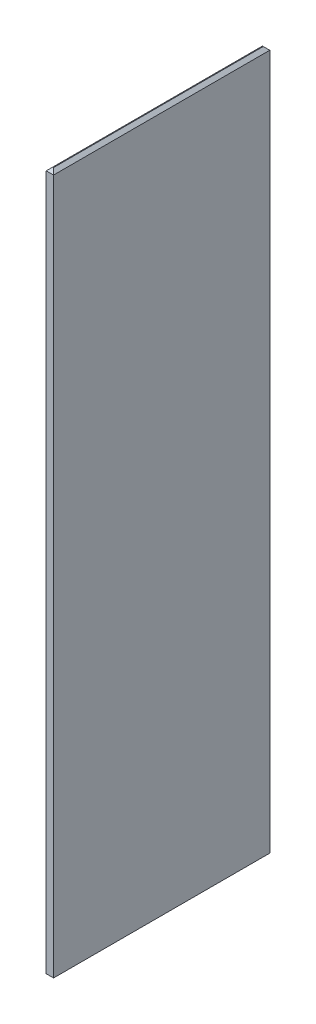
SolidWorks part; units mm, degrees
ref_plane "Front Plane" through (0, 0, 0) normal (1, 0, 0) x (0, 1, 0)
ref_plane "Top Plane" through (0, 0, 0) normal (0, 0, 1) x (0, 1, 0)
ref_plane "Right Plane" through (0, 0, 0) normal (0, 1, 0) x (-1, 0, 0)
sketch "Sketch1" plane through (0, 0, 0) normal (0, 1, 0) x (-1, 0, 0)
  line L1 (-50.8, 1500) -> (50.8, 1500)
  line L2 (-50.8, 1500) -> (-50.8, -1500)
  line L3 (-50.8, -1500) -> (50.8, -1500)
  line L4 (50.8, 1500) -> (50.8, -1500)
  line L5 (-50.8, 1500) -> (50.8, -1500) construction
  line L6 (-50.8, -1500) -> (50.8, 1500) construction
  point P0 (0, 0)
  dimension "D1" = 3000
  dimension "D2" = 101.6
extrude "Boss-Extrude1" add sketch "Sketch1" along normal blind 9739.6
ref_plane "Mating plane" through (0, 0, -1750) normal (0, 0, -1) x (0, 1, 0)
chamfer "Chamfer1" distance 45 angle 45 8 edges at (0, 0, 1500) (50.8, 0, 0) (0, 0, -1500) (-50.8, 0, 0) (0, 9739.6, -1500) (50.8, 9739.6, 0) (0, 9739.6, 1500) (-50.8, 9739.6, 0)
